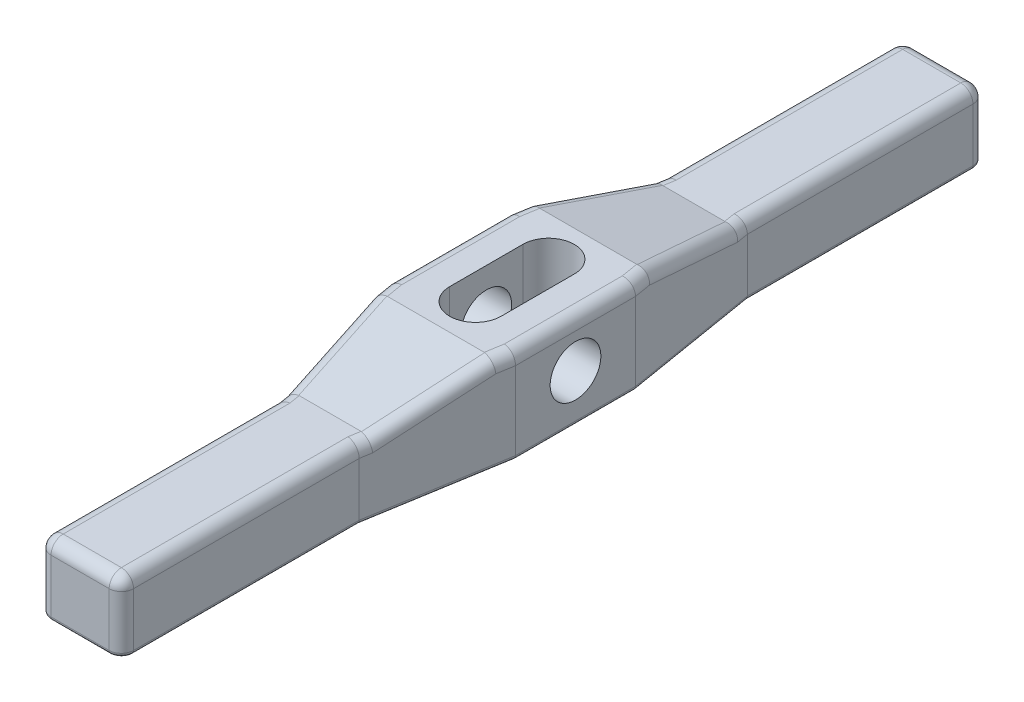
SolidWorks part; units mm, degrees
ref_plane "Front Plane" through (0, 0, 0) normal (0, 0, 1) x (1, 0, 0)
ref_plane "Top Plane" through (0, 0, 0) normal (0, 1, 0) x (1, 0, 0)
ref_plane "Right Plane" through (0, 0, 0) normal (1, 0, 0) x (0, 0, -1)
sketch "Sketch1" plane through (0, 0, 0) normal (0, 1, 0) x (1, 0, 0)
  line L0 (0, 0) -> (68.8474, 0) construction
  line L1 (0, 0) -> (0, 75.643) construction
  line L2 (-5.1562, 53.975) -> (5.1562, 53.975)
  line L3 (5.1562, 53.975) -> (5.1562, 24.257)
  line L4 (5.1562, 24.257) -> (7.9375, 7.4966)
  line L5 (7.9375, 7.4966) -> (7.9375, -7.4966)
  line L6 (5.1562, -24.257) -> (7.9375, -7.4966)
  line L7 (5.1562, -53.975) -> (5.1562, -24.257)
  line L8 (-5.1562, -53.975) -> (5.1562, -53.975)
  line L9 (-5.1562, -53.975) -> (-5.1562, -24.257)
  line L10 (-5.1562, -24.257) -> (-7.9375, -7.4966)
  line L11 (-7.9375, 7.4966) -> (-7.9375, -7.4966)
  line L12 (-5.1562, 24.257) -> (-7.9375, 7.4966)
  line L13 (-5.1562, 53.975) -> (-5.1562, 24.257)
  line L14 (-3.2131, 4.572) -> (-3.2131, -4.572)
  line L15 (3.2131, 4.572) -> (3.2131, -4.572)
  arc A0 (3.2131, 4.572) -> (-3.2131, 4.572) centre (0, 4.572) ccw
  arc A1 (-3.2131, -4.572) -> (3.2131, -4.572) centre (0, -4.572) ccw
  dimension "D1" = 10.3124
  dimension "D2" = 107.95
  dimension "D3" = 15.875
  dimension "D4" = 29.718
  dimension "D5" = 14.9931
  dimension "D6" = 9.144
  dimension "D7" = 6.4262
extrude "Extrude1" add sketch "Sketch1" along normal blind 11.7602
sketch "Sketch2" plane through (7.9375, 0, 0) normal (1, 0, 0) x (0, 0, -1)
  line L0 (0, 0) -> (0, 25.2428) construction
  line L1 (-7.4966, 0) -> (7.4966, 0) construction
  line L2 (53.975, 11.7602) -> (9.525, 11.7602)
  line L3 (7.4966, 11.7602) -> (24.257, 11.7602) construction
  line L4 (9.525, 11.7602) -> (22.7273, 8.7122)
  line L5 (22.7273, 8.7122) -> (53.975, 8.7122)
  line L6 (53.975, 11.7602) -> (53.975, 0) construction
  line L7 (53.975, 8.7122) -> (53.975, 11.7602)
  line L8 (24.257, 0) -> (53.975, 0) construction
  line L9 (-53.975, 8.7122) -> (-53.975, 11.7602)
  line L10 (-22.7273, 8.7122) -> (-53.975, 8.7122)
  line L11 (-9.525, 11.7602) -> (-22.7273, 8.7122)
  line L12 (-53.975, 11.7602) -> (-9.525, 11.7602)
  dimension "D1" = 9.525
  dimension "D2" = 13
  dimension "D3" = 8.7122
extrude "Cut-Extrude1" cut sketch "Sketch2" against normal through all
sketch "Sketch3" plane through (7.9375, 0, 0) normal (1, 0, 0) x (0, 0, -1)
  line L0 (-7.4966, 0) -> (7.4966, 0) construction
  circle A0 centre (0, 5.9436) radius 3.1686
  dimension "D1" = 6.3373
  dimension "D2" = 5.9436
extrude "Cut-Extrude2" cut sketch "Sketch3" against normal through all
fillet "Fillet1" radius 1.524 4 edges at (-5.1562, 4.3561, -53.975) (5.1562, 4.3561, -53.975) (5.1562, 4.3561, 53.975) (-5.1562, 4.3561, 53.975)
fillet "Fillet2" radius 0.508 16 edges at (-5.1562, 0, 38.354) (-4.7098, 0, 53.5286) (0, 0, 53.975) (4.7098, 0, 53.5286) (-5.1562, 0, -38.354) (-4.7098, 0, -53.5286) (0, 0, -53.975) (4.7098, 0, -53.5286) (-6.5469, 0, -15.8768) (-7.9375, 0, 0) (-6.5469, 0, 15.8768) (5.1562, 0, 38.354) (6.5469, 0, 15.8768) (7.9375, 0, 0) (6.5469, 0, -15.8768) (5.1562, 0, -38.354)
fillet "Fillet3" radius 1.524 24 edges at (-4.7098, 8.7122, 53.5286) (0, 8.7122, 53.975) (4.7098, 8.7122, 53.5286) (-5.1562, 8.7122, -38.354) (-4.7098, 8.7122, -53.5286) (0, 8.7122, -53.975) (4.7098, 8.7122, -53.5286) (-5.2831, 8.7122, -23.4922) (-6.5055, 10.2362, -16.1262) (-7.7692, 11.7602, -8.5108) (-7.7692, 11.7602, 8.5108) (-7.9375, 11.7602, 0) (-6.5055, 10.2362, 16.1262) (-5.1562, 8.7122, 38.354) (-5.2831, 8.7122, 23.4922) (5.1562, 8.7122, 38.354) (5.2831, 8.7122, 23.4922) (6.5055, 10.2362, 16.1262) (7.7692, 11.7602, 8.5108) (7.9375, 11.7602, 0) (7.7692, 11.7602, -8.5108) (5.2831, 8.7122, -23.4922) (6.5055, 10.2362, -16.1262) (5.1562, 8.7122, -38.354)
